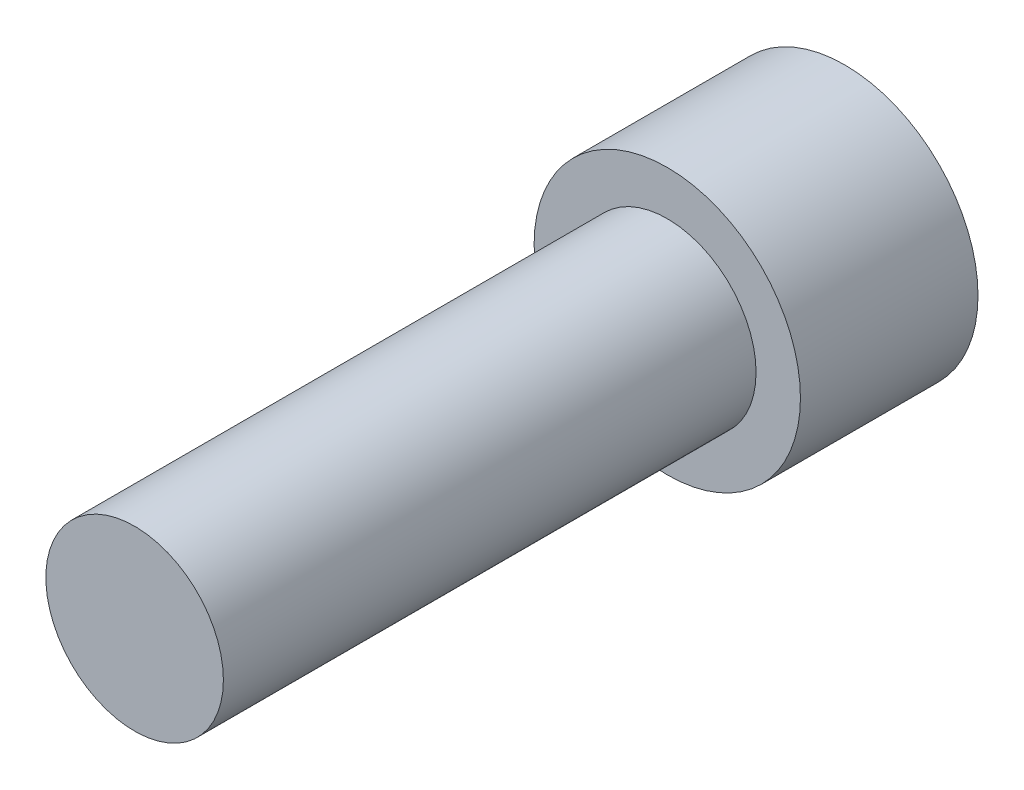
SolidWorks part; units mm, degrees
ref_plane "Front Plane" through (0, 0, 0) normal (0, 0, 1) x (1, 0, 0)
ref_plane "Top Plane" through (0, 0, 0) normal (0, 1, 0) x (1, 0, 0)
ref_plane "Right Plane" through (0, 0, 0) normal (1, 0, 0) x (0, 0, -1)
sketch "Sketch6" plane through (0, 0, 0) normal (1, 0, 0) x (0, 0, -1)
  line L0 (-38.1, 0) -> (22.525, 0) construction
  line L1 (10.4775, 0) -> (-10.4775, 0) construction
  line L2 (-38.1, 0) -> (-38.1, -6.35)
  line L3 (-38.1, -6.35) -> (0, -6.35)
  line L4 (0, 10.4775) -> (0, -10.4775) construction
  line L5 (0, -6.35) -> (0, -9.525)
  line L6 (0, -9.525) -> (12.7, -9.525)
  line L7 (12.7, -9.525) -> (12.7, 0)
  line L8 (12.7, 0) -> (-38.1, 0)
  dimension "L" = 38.1
  dimension "H" = 12.7
  dimension "A" = 19.05
  dimension "D" = 12.7
revolve "Revolve1" add sketch "Sketch6" angle 360 about L0
sketch "Sketch7" plane through (0, 0, -12.7) normal (0, 0, -1) x (-1, 0, 0)
  line L2 (-4.7625, 2.7496) -> (-4.7625, -2.7496)
  line L4 (-4.7625, -2.7496) -> (0, -5.4993)
  line L5 (0, -5.4993) -> (4.7625, -2.7496)
  line L6 (4.7625, -2.7496) -> (4.7625, 2.7496)
  line L7 (4.7625, 2.7496) -> (0, 5.4993)
  line L8 (0, 5.4993) -> (-4.7625, 2.7496)
  circle A0 centre (0, 0) radius 4.7625 construction
  dimension "J" = 9.525
extrude "HEX" cut sketch "Sketch7" against normal blind 7.112
